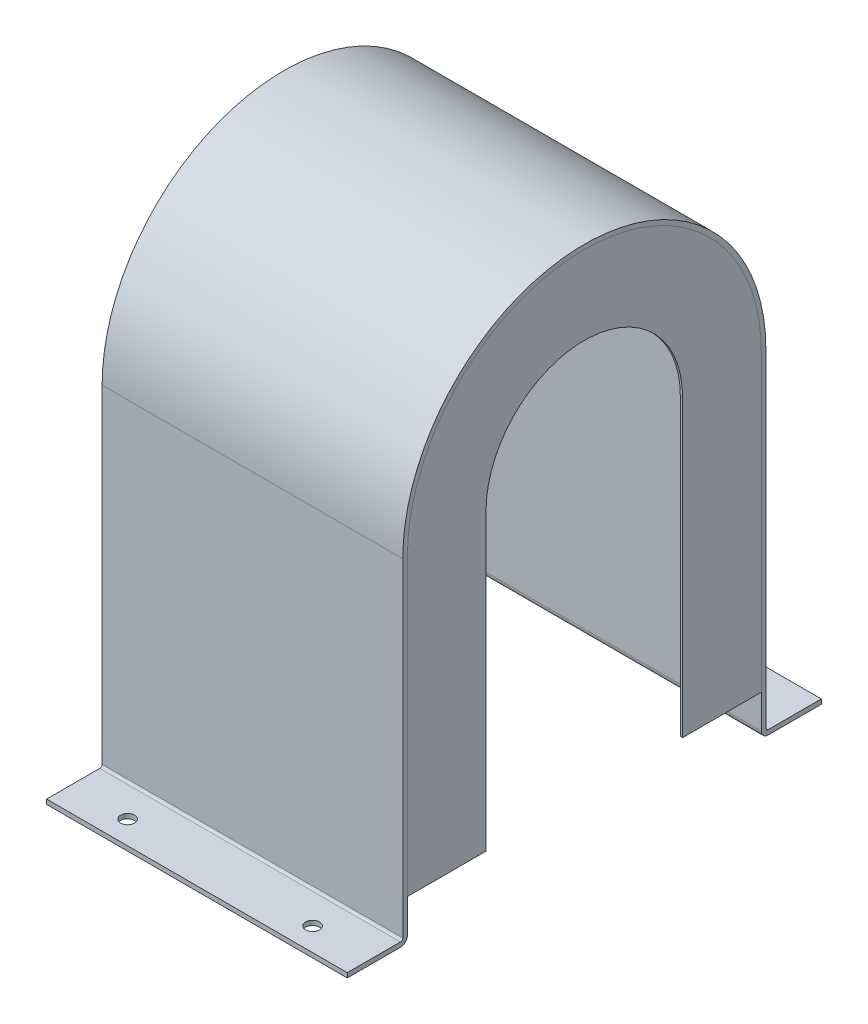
SolidWorks part; units mm, degrees
ref_plane "Front Plane" through (0, 0, 0) normal (0, 0, 1) x (1, 0, 0)
ref_plane "Top Plane" through (0, 0, 0) normal (0, 1, 0) x (1, 0, 0)
ref_plane "Right Plane" through (0, 0, 0) normal (1, 0, 0) x (0, 0, -1)
sketch "Sketch1" plane through (0, 0, 0) normal (1, 0, 0) x (0, 0, -1)
  line L0 (157, 0) -> (157, -284)
  line L1 (159, -286) -> (205, -286)
  line L2 (-157, 0) -> (-157, -284)
  line L3 (-159, -286) -> (-205, -286)
  line L4 (159, -290) -> (205, -290)
  line L5 (153, 0) -> (153, -284)
  line L6 (-153, 0) -> (-153, -284)
  line L7 (-159, -290) -> (-205, -290)
  line L8 (-205, -286) -> (-205, -290)
  line L9 (205, -286) -> (205, -290)
  arc A0 (157, 0) -> (-157, 0) centre (0, 0) ccw
  arc A1 (157, -284) -> (159, -286) centre (159, -284) ccw
  arc A2 (-157, -284) -> (-159, -286) centre (-159, -284) cw
  arc A3 (153, -284) -> (159, -290) centre (159, -284) ccw
  arc A4 (153, 0) -> (-153, 0) centre (0, 0) ccw
  arc A5 (-153, -284) -> (-159, -290) centre (-159, -284) cw
  arc A6 (157, 0) -> (-157, 0) centre (0, 0) ccw construction
  point P15 (-157, -286)
  dimension "D1" = 314
  dimension "D4" = 2
  dimension "D2" = 447
  dimension "D3" = 48
  dimension "D5" = 4
extrude "Boss-Extrude1" add sketch "Sketch1" along normal mid plane 260 contours A0 L2 A2 L3 L8 L7 A5 L6 A4 L5 A3 L4 L9 L1 A1 L0
sketch "Sketch2" plane through (130, 0, 0) normal (1, 0, 0) x (0, 0, -1)
  line L0 (-153, 0) -> (-153, -255)
  line L2 (-153, -255) -> (153, -255)
  line L4 (153, -255) -> (153, 0)
  line L5 (-153, 0) -> (-153, -284) construction
  line L6 (153, 0) -> (153, -284) construction
  line L7 (159, -290) -> (205, -290) construction
  arc A0 (-153, 0) -> (153, 0) centre (0, 0) cw
  arc A2 (153, 0) -> (-153, 0) centre (0, 0) ccw construction
  circle A3 centre (0, 0) radius 85
  dimension "D1" = 35
  dimension "D2" = 170
extrude "Boss-Extrude2" add sketch "Sketch2" against normal blind 2 separate body contours L2 L4 A0 L0 | A3
mirror "Mirror4" about plane through (0, 0, 0) normal (1, 0, 0)
sketch "Sketch3" plane through (0, -286, 0) normal (0, 1, 0) x (1, 0, 0)
  line L0 (80, -185) -> (-80, -185) construction
  line L1 (0, -205) -> (0, -185) construction
  line L2 (130, -205) -> (-130, -205) construction
  circle A0 centre (-80, -185) radius 6
  circle A1 centre (80, -185) radius 6
  dimension "D1" = 12
  dimension "D2" = 20
  dimension "D3" = 160
extrude "Cut-Extrude1" cut sketch "Sketch3" against normal through all
mirror "Mirror5" about plane through (0, 0, 0) normal (0, 0, 1) of "Cut-Extrude1"
sketch "Sketch4" plane through (-130, 0, 0) normal (-1, 0, 0) x (0, 0, 1)
  line L0 (85, 0) -> (85, -255)
  line L1 (153, -255) -> (-153, -255) construction
  line L2 (85, -255) -> (-85, -255)
  line L3 (-85, -255) -> (-85, 0)
  line L4 (-85, 0) -> (85, 0)
  circle A0 centre (0, 0) radius 85 construction
  dimension "D1" = 170
extrude "Cut-Extrude2" cut sketch "Sketch4" against normal through all
